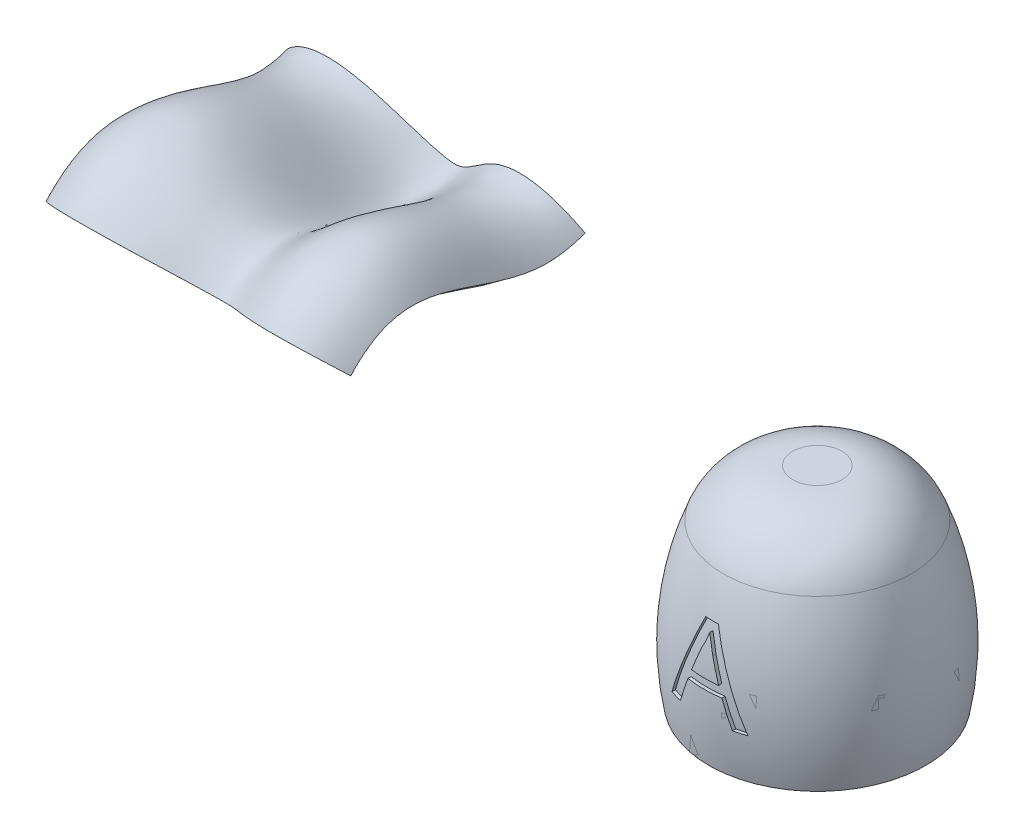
SolidWorks part; units mm, degrees
ref_plane "Front Plane" through (0, 0, 0) normal (0, 0, 1) x (1, 0, 0)
ref_plane "Top Plane" through (0, 0, 0) normal (0, 1, 0) x (1, 0, 0)
ref_plane "Right Plane" through (0, 0, 0) normal (1, 0, 0) x (0, 0, -1)
sketch "Sketch1" plane through (0, 0, 0) normal (1, 0, 0) x (0, 0, -1)
  spline S0 degree 3 poles (-81.7388, 22.5697) (-22.1774, 88.2281) (40.3018, 2.3227) (106.3418, 28.8729) knots 0 0 0 0 1 1 1 1
ref_plane "Plane1" through (0, 28.8729, -106.3418) normal (0, 0.373, -0.9278) x (-1, 0, 0)
sketch "Sketch2" plane through (0, 28.8729, -106.3418) normal (0, 0.373, -0.9278) x (-1, 0, 0)
  spline S0 degree 3 poles (-82.5623, -11.8776) (-44.4296, 42.01) (12.4672, -95.6347) (84.4595, 48.8531) (128.8868, 1.9451) knots 0 0 0 0 0.443178 1 1 1 1
surface "Surface-Sweep1"
sketch "Sketch3" plane through (0, 0, 0) normal (0, 0, 1) x (1, 0, 0)
  line L0 (385.524, 64.9627) -> (385.524, -98.5118)
  line L1 (385.524, 64.9627) -> (405.1122, 64.9627)
  line L2 (385.524, -98.5118) -> (471.7802, -98.5118)
  arc A0 (405.1122, 64.9627) -> (460.0961, 27.4884) centre (405.1122, 5.8882) cw
  arc A1 (460.0961, 27.4884) -> (471.7802, -98.5118) centre (248.3704, -55.6869) cw
revolve "Revolve1" add sketch "Sketch3" angle 360 about L0
ref_plane "Plane2" through (0, 0, 96.52) normal (0, 0, 1) x (1, 0, 0)
surface "Surface-Offset1" parameters "D1"=12.7
surface "Surface-Offset2" parameters "D1"=2.54
sketch "Sketch4" plane through (0, 0, 96.52) normal (0, 0, 1) x (1, 0, 0)
  line L0 (295.342, -63.7133) -> (475.706, -63.7133) construction
  arc A0 (310.9519, 27.4884) -> (299.2678, -98.5118) centre (522.6776, -55.6869) ccw construction
  arc A1 (471.7802, -98.5118) -> (460.0961, 27.4884) centre (248.3704, -55.6869) ccw construction
  text T0 "A" font "Arial" height 63.5
extrude "Cut-Extrude1" cut sketch "Sketch4" against normal up to surface (10.1491 mm away)
surface "Surface-Offset3" parameters "D1"=0
